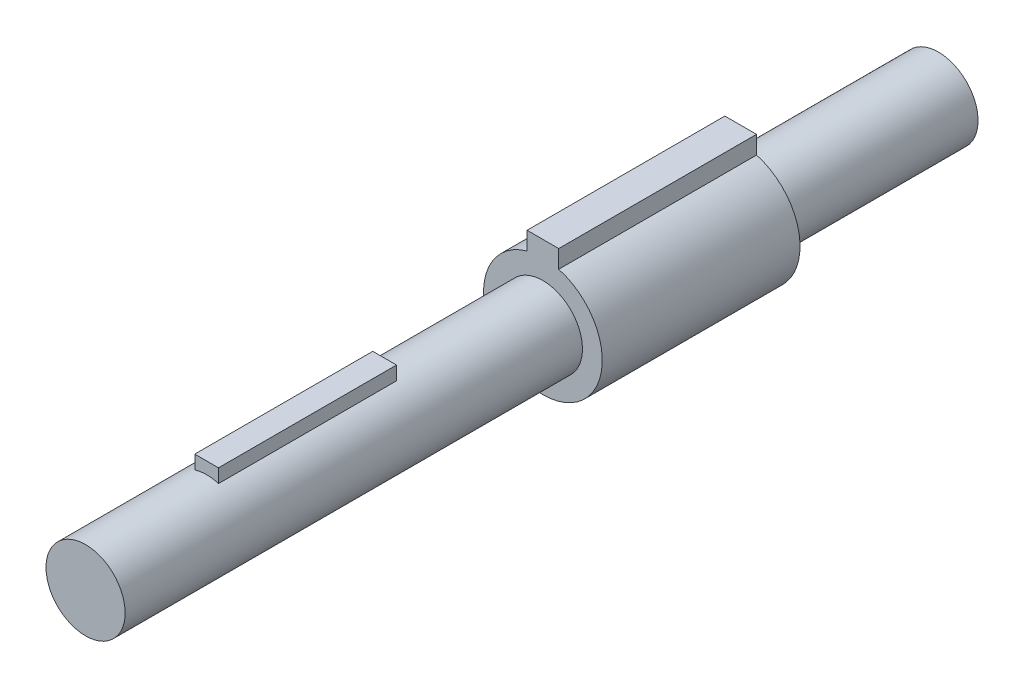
SolidWorks part; units mm, degrees
ref_plane "Front Plane" through (0, 0, 0) normal (0, 0, 1) x (1, 0, 0)
ref_plane "Top Plane" through (0, 0, 0) normal (0, 1, 0) x (1, 0, 0)
ref_plane "Right Plane" through (0, 0, 0) normal (1, 0, 0) x (0, 0, -1)
sketch "Sketch2" plane through (0, 0, 0) normal (0, 0, 1) x (1, 0, 0)
  line L0 (0, 0) -> (0, 32.371) construction
  line L2 (3.81, 16.51) -> (-3.81, 16.51)
  line L3 (3.81, 16.51) -> (3.81, 12.115)
  line L5 (-3.81, 16.51) -> (-3.81, 12.115)
  line L6 (3.81, 16.51) -> (-7.6847, 5.0153) construction
  line L7 (3.9912, 8.7088) -> (-3.81, 16.51) construction
  arc A0 (-3.81, 12.115) -> (3.81, 12.115) centre (0, 0) ccw
  point P3 (0, 12.7)
  dimension "D1" = 25.4
  dimension "D2" = 7.62
  dimension "D3" = 3.81
  dimension "D4" = 3.81
extrude "Boss-Extrude1" add sketch "Sketch2" along normal blind 57.15
sketch "Sketch3" plane through (0, 0, 57.15) normal (0, 0, 1) x (1, 0, 0)
  circle A0 centre (0, 0) radius 12.7
extrude "Boss-Extrude2" add sketch "Sketch3" along normal blind 38.862
sketch "Sketch4" plane through (0, 0, 0) normal (0, 0, -1) x (-1, 0, 0)
  circle A0 centre (0, 0) radius 12.7
extrude "Boss-Extrude3" add sketch "Sketch4" along normal blind 50.8
sketch "Sketch6" plane through (0, 0, -50.8) normal (0, 0, -1) x (-1, 0, 0)
  line L0 (0, 0) -> (0, 12.562) construction
  line L2 (5.08, 24.13) -> (-5.08, 24.13)
  line L3 (5.08, 24.13) -> (5.08, 18.3602)
  line L5 (-5.08, 24.13) -> (-5.08, 18.3602)
  line L6 (5.08, 24.13) -> (0, 19.05) construction
  line L7 (0, 19.05) -> (-5.08, 24.13) construction
  arc A0 (-5.08, 18.3602) -> (5.08, 18.3602) centre (0, 0) ccw
  point P4 (0, 19.05)
  dimension "D1" = 38.1
  dimension "D2" = 10.16
extrude "Boss-Extrude4" add sketch "Sketch6" along normal blind 63.5
sketch "Sketch7" plane through (0, 0, -114.3) normal (0, 0, -1) x (-1, 0, 0)
  circle A0 centre (0, 0) radius 12.7
  dimension "D1" = 25.4
extrude "Boss-Extrude5" add sketch "Sketch7" along normal blind 63.5
